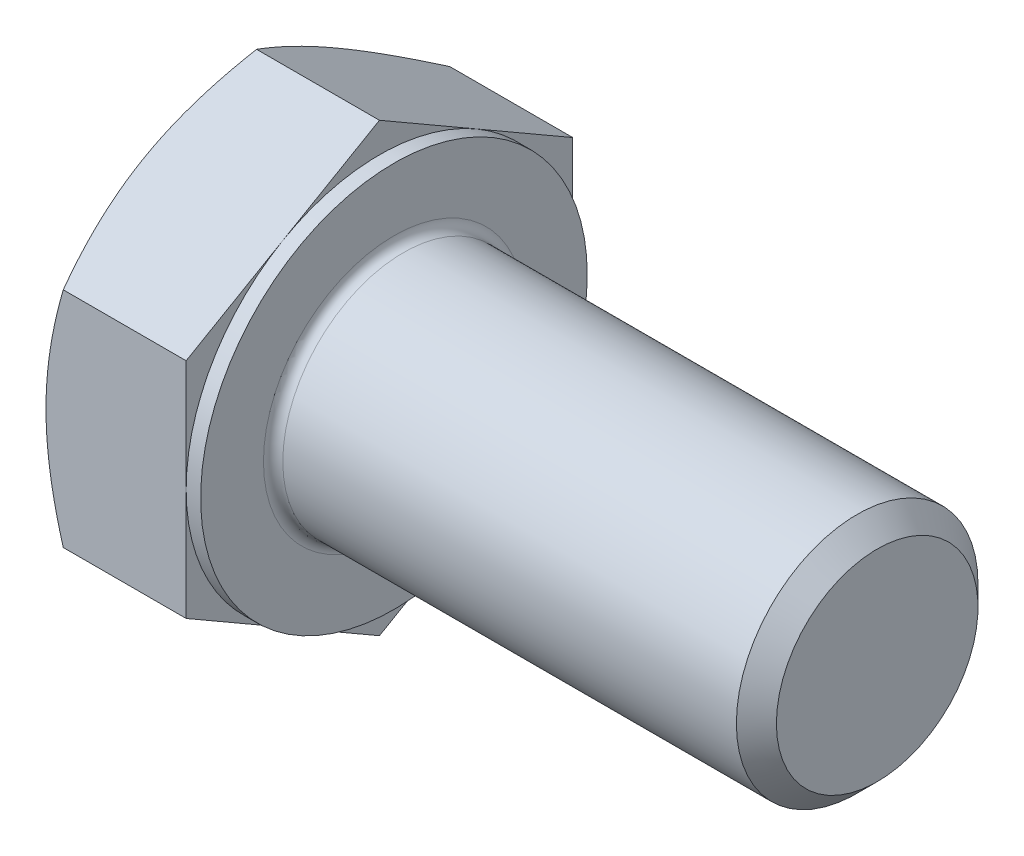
SolidWorks part; units mm, degrees
ref_plane "Plane1" through (0, 0, 0) normal (0, 0, 1) x (1, 0, 0)
ref_plane "Plane2" through (0, 0, 0) normal (0, 1, 0) x (1, 0, 0)
ref_plane "Plane3" through (0, 0, 0) normal (1, 0, 0) x (0, 0, -1)
extrude "BaseHead" add sketch "Sketch1" along normal blind 6.4
sketch "Sketch1" plane through (0, 0, 0) normal (1, 0, 0) x (0, 0, -1)
  line L0 (8, 4.6188) -> (8, -4.6188)
  line L1 (-8, 4.6188) -> (-8, -4.6188)
  line L2 (8, -4.6188) -> (0, -9.2376)
  line L3 (0, -9.2376) -> (-8, -4.6188)
  line L4 (8, 4.6188) -> (0, 9.2376)
  line L5 (0, 9.2376) -> (-8, 4.6188)
  dimension "Width_flats" = 16
  dimension "D2" = 120
  dimension "D3" = 8
  dimension "D4" = 8
  dimension "D5" = 8
revolve "BearingFace" cut sketch "Sketch4"
sketch "Sketch4"
  line L1 (6.4, 9.2376) -> (6.4, 4.6188) construction
  line L2 (6.4, 8) -> (5.8, 8)
  line L3 (6.4, 8) -> (6.4, 19.2376)
  line L4 (6.4, 19.2376) -> (5.8, 19.2376)
  line L5 (0, 0) -> (95.25, 0) construction
  line L6 (0, 0) -> (96.52, 0) construction
  line L7 (5.8, 8) -> (5.8, 19.2376)
  line L8 (6.4, 9.2376) -> (0.7145, 9.2376) construction
revolve "HeadChamfer" cut sketch "Sketch3" angle 360 about L6
sketch "Sketch3" plane through (0, 0, 0) normal (0, 0, 1) x (1, 0, 0)
  line L0 (0, 8) -> (3.6013, 14.2376)
  line L1 (0, 9.2376) -> (0, 4.6188) construction
  line L2 (3.6013, 14.2376) -> (3.6013, 19.2376)
  line L3 (3.6013, 19.2376) -> (-10, 19.2376)
  line L4 (-10, 19.2376) -> (-10, 8)
  line L5 (-10, 8) -> (0, 8)
  line L6 (0, 0) -> (99.06, 0) construction
  line L7 (6.4, 9.2376) -> (0, 9.2376) construction
  dimension "D1" = 8
  dimension "D2" = 5
  dimension "D3" = 10
  dimension "D4" = 5
  dimension "Head_ch_ang" = 30
sketch "BodySke" plane through (0, 0, 0) normal (0, 0, 1) x (1, 0, 0)
  line L0 (0, 4.6188) -> (0, -4.6188) construction
  line L1 (0, 0) -> (26.4, 0)
  line L2 (0, 0) -> (0, 5)
  line L3 (0, 5) -> (25.572, 5)
  line L4 (26.4, 0) -> (26.4, 4.172)
  line L5 (6.4, 9.2376) -> (6.4, 4.6188) construction
  line L6 (26.4, 4.172) -> (25.572, 5)
  line L7 (0, 0) -> (96.52, 0) construction
  line L8 (26.4, -4.172) -> (25.572, -5) construction
  line L9 (0, -5) -> (25.572, -5) construction
  line L10 (7.9, 15.24) -> (7.9, -1.27) construction
  line L12 (6.4, 4.6188) -> (6.4, -4.6188) construction
  dimension "Length" = 20
  dimension "Body_ch_ang" = 45
  dimension "Diameter" = 10
  dimension "Minor_dia" = 8.344
  dimension "Advance" = 1.5
revolve "BaseBody" add sketch "BodySke"
fillet "HeadFillet" radius 0.4 1 edges at (6.4, 0, -5)
sketch "ThdSchSke" plane through (0, 0, 0) normal (0, 0, 1) x (1, 0, 0)
  line L0 (7.9, -4.172) -> (7.3202, -5)
  line L1 (7.9, -4.172) -> (8.4798, -5)
  line L2 (8.4798, -5) -> (8.4798, -6.25)
  line L3 (-3.175, 0) -> (5.1513, 0) construction
  line L5 (8.4798, -6.25) -> (7.3202, -6.25)
  line L6 (7.3202, -6.25) -> (7.3202, -5)
  dimension "Thread_minor" = 8.344
  dimension "Diameter" = 10
  dimension "Start" = 7.9
  dimension "SideAngle" = 55
  dimension "VeeAngle" = 70
  dimension "Overcut" = 12.5
revolve "ThreadSchematic" [suppressed] cut sketch "ThdSchSke" angle 360 about L3
pattern_linear "ThdSchPat" [suppressed]
equation "\"D3@Sketch1\" = \"Width_flats@Sketch1\" / 2"
equation "\"D4@Sketch1\" = \"D3@Sketch1\""
equation "\"D5@Sketch1\" = \"D4@Sketch1\""
equation "\"Thread_minor@ThreadCosmetic\" = \"Minor_dia@BodySke\""
equation "\"D1@Sketch3\" = \"Width_flats@Sketch1\" / 2"
equation "\"D1@Sketch4\" = \"Width_flats@Sketch1\""
equation "\"Thread_length@ThreadCosmetic\" = \"Length@BodySke\" - \"Advance@BodySke\""
equation "\"Thread_minor@ThdSchSke\" = \"Minor_dia@BodySke\""
equation "\"Diameter@ThdSchSke\" = \"Diameter@BodySke\""
equation "\"Overcut@ThdSchSke\" = \"Diameter@BodySke\" * 1.25"
equation "\"Start@ThdSchSke\" = \"Head_ht@BaseHead\" + \"Length@BodySke\" - \"Thread_length@ThreadCosmetic\"  '---Non-countersunk---"
equation "\"Num_threads@ThdSchPat\" = int( \"Thread_length@ThreadCosmetic\" / \"Advance@BodySke\" + 0.999 )  + 1"
equation "\"Advance@ThdSchPat\" = \"Thread_length@ThreadCosmetic\" /  (\"Num_threads@ThdSchPat\" - 1) 'relax it"
equation "\"Num_threads@ThdSchPat\" = \"Num_threads@ThdSchPat\" - sgn( \"Num_threads@ThdSchPat\" - 1) '---chamfered tips only---"
